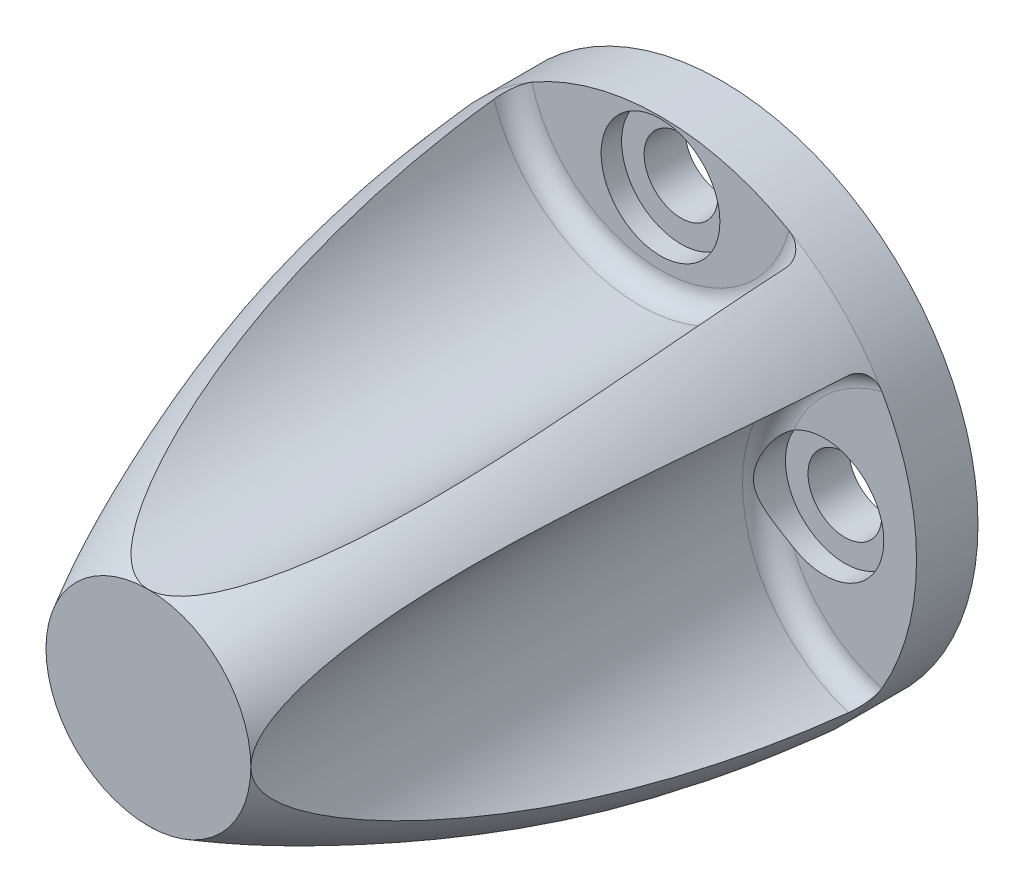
SolidWorks part; units mm, degrees
ref_plane "Front Plane" through (0, 0, 0) normal (0, 0, 1) x (1, 0, 0)
ref_plane "Top Plane" through (0, 0, 0) normal (0, 1, 0) x (1, 0, 0)
ref_plane "Right Plane" through (0, 0, 0) normal (1, 0, 0) x (0, 0, -1)
sketch "Sketch1" plane through (0, 0, 0) normal (0, 0, 1) x (1, 0, 0)
  circle A0 centre (0, 0) radius 12.5
  dimension "D1" = 25
extrude "Boss-Extrude1" add sketch "Sketch1" along normal blind 3
sketch "Sketch2" plane through (0, 0, 3) normal (0, 0, 1) x (1, 0, 0)
  circle A0 centre (0, 0) radius 9.5 construction
  circle A1 centre (0, 0) radius 8 construction
  circle A2 centre (0, 9.5) radius 1.8
  circle A3 centre (0, -9.5) radius 1.8
  circle A4 centre (8, 0) radius 1.8
  circle A5 centre (-8, 0) radius 1.8
  dimension "D1" = 19
  dimension "D2" = 16
  dimension "D3" = 3.6
extrude "Cut-Extrude1" cut sketch "Sketch2" against normal through all
sketch "Sketch3" plane through (0, 0, 3) normal (0, 0, 1) x (1, 0, 0)
  arc A0 (-7.1545, 10.25) -> (7.1545, 10.25) centre (0, 12.5) ccw
  circle A1 centre (0, 0) radius 12.5 construction
  arc A2 (10.25, 7.1545) -> (10.25, -7.1545) centre (12.5, 0) ccw
  arc A3 (7.1545, -10.25) -> (-7.1545, -10.25) centre (0, -12.5) ccw
  arc A4 (-10.25, -7.1545) -> (-10.25, 7.1545) centre (-12.5, 0) ccw
  arc A5 (10.25, 7.1545) -> (7.1545, 10.25) centre (0, 0) ccw
  circle A6 centre (0, 0) radius 12.5
  arc A7 (7.1545, -10.25) -> (10.25, -7.1545) centre (0, 0) ccw
  arc A8 (-7.1545, 10.25) -> (-10.25, 7.1545) centre (0, 0) ccw
  arc A9 (-10.25, -7.1545) -> (-7.1545, -10.25) centre (0, 0) ccw
  point P4 (0, 0)
  point P6 (0, 0)
  point P7 (0, 0)
  point P14 (0, 0)
  dimension "D1" = 15
  dimension "D3" = 17.6777
  dimension "D4" = 0
  dimension "D2" = 4
extrude "Boss-Extrude2" add sketch "Sketch3" along normal blind 25 contours A7 A2 A5 A0 A8 A4 A9 A3
sketch "Sketch5" plane through (0, 0, 0) normal (0, 1, 0) x (1, 0, 0)
  line L0 (10.25, -28) -> (10.25, -3) construction
  line L1 (-7.1545, -28) -> (7.1545, -28) construction
  line L2 (12.5, -3) -> (12.5, -28)
  line L3 (12.5, -28) -> (5, -28)
  line L4 (0, -28) -> (0, -7.44) construction
  spline S0 degree 2 poles (12.5, -3) (11.5082, -16.3167) (5, -28) knots 0 0 0 1 1 1
  dimension "D1" = 5
revolve "Cut-Revolve2" cut sketch "Sketch5" angle 360 about L4
sketch "Sketch6" plane through (0, 0, 0) normal (0, 0, -1) x (-1, 0, 0)
  circle A0 centre (0, 0) radius 3
  dimension "D1" = 6
extrude "Cut-Extrude2" cut sketch "Sketch6" against normal blind 5
fillet "Fillet1" radius 1 4 edges at (0, 5, 3) (5, 0, 3) (0, -5, 3) (-5, 0, 3)
sketch "Sketch7" plane through (0, 0, 3) normal (0, 0, 1) x (1, 0, 0)
  circle A0 centre (0, 9.5) radius 2.9
  circle A1 centre (8, 0) radius 2.9
  circle A2 centre (0, -9.5) radius 2.9
  circle A3 centre (-8, 0) radius 2.9
  dimension "D1" = 5.8
extrude "Cut-Extrude3" cut sketch "Sketch7" against normal blind 1 and the other way through all
